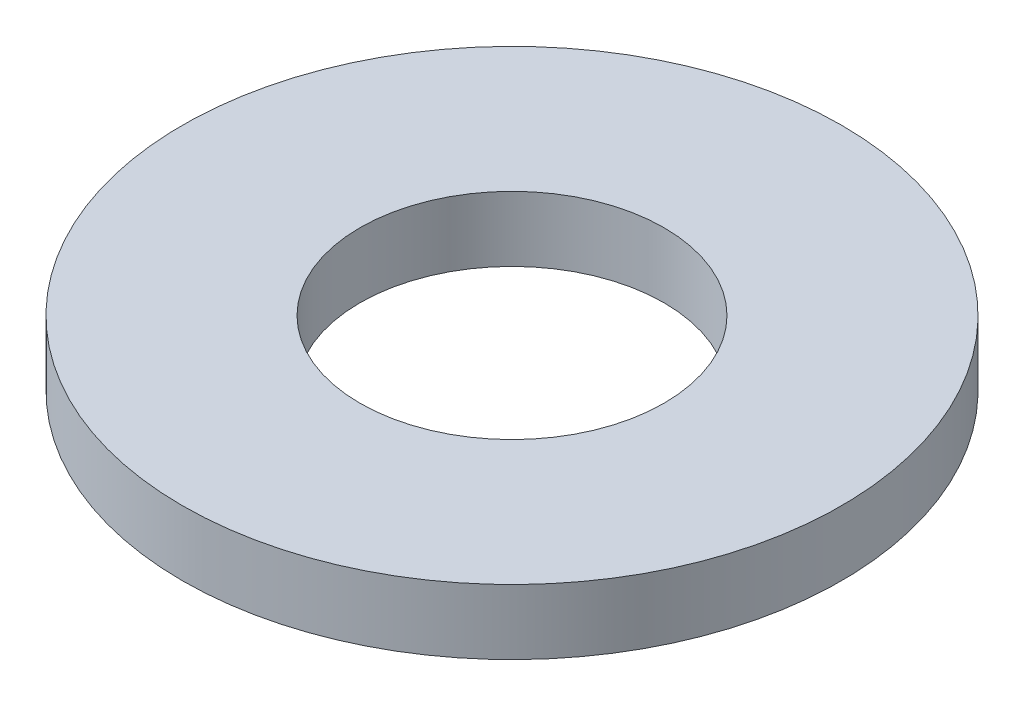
SolidWorks part; units mm, degrees
ref_plane "Front Plane" through (0, 0, 0) normal (0, 0, 1) x (1, 0, 0)
ref_plane "Top Plane" through (0, 0, 0) normal (0, 1, 0) x (1, 0, 0)
ref_plane "Right Plane" through (0, 0, 0) normal (1, 0, 0) x (0, 0, -1)
sketch "Sketch1" plane through (0, 0, 0) normal (0, 0, 1) x (1, 0, 0)
  line L0 (4.7625, 0.9398) -> (2.1971, 0.9398)
  line L1 (2.1971, 0.9398) -> (2.1971, 0)
  line L2 (2.1971, 0) -> (4.7625, 0)
  line L3 (4.7625, 0) -> (4.7625, 0.9398)
  line L4 (0, 0.9398) -> (0, 0) construction
revolve "Revolve1" add sketch "Sketch1" angle 360 about L4
